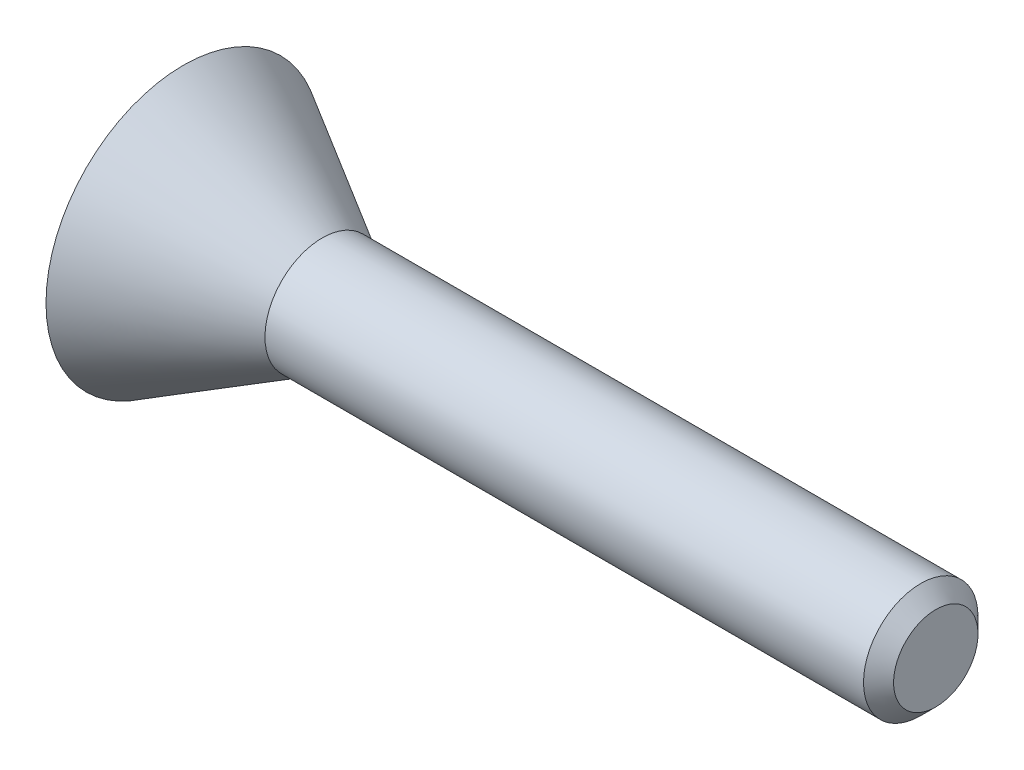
SolidWorks part; units mm, degrees
ref_plane "Front Plane" through (0, 0, 0) normal (0, 0, 1) x (1, 0, 0)
ref_plane "Top Plane" through (0, 0, 0) normal (0, 1, 0) x (1, 0, 0)
ref_plane "Right Plane" through (0, 0, 0) normal (1, 0, 0) x (0, 0, -1)
sketch "Sketch1" plane through (0, 0, 0) normal (1, 0, 0) x (0, 0, -1)
  circle A0 centre (0, 0) radius 4.2
  dimension "D1" = 8.4
extrude "Boss-Extrude1" add sketch "Sketch1" along normal mid plane 23 contours A0
sketch "Sketch2" plane through (0, 0, 0) normal (0, 0, 1) x (1, 0, 0)
  line L0 (-7.2565, 1.75) -> (11.5, 1.75)
  line L1 (11.5, -4.2) -> (11.5, 4.2) construction
  line L2 (11.5, 1.75) -> (11.5, 4.2)
  line L3 (-7.2565, 1.75) -> (-11.5, 4.2)
  line L4 (-11.5, 4.2) -> (11.5, 4.2)
  line L5 (-11.5, 4.2) -> (-11.5, -4.2) construction
  line L6 (-11.5, 0) -> (11.5, 0) construction
  dimension "D1" = 30
  dimension "D2" = 3.5
revolve "Cut-Revolve1" cut sketch "Sketch2" angle 360 about L6
sketch "Sketch3" plane through (-11.5, 0, 0) normal (-1, 0, 0) x (0, 0, 1)
  line L1 (0.42, 1.85) -> (0.42, -2.77)
  line L2 (1.01, 1.85) -> (0.42, 1.85)
  line L3 (0, 3.53) -> (1.01, 1.85)
  line L4 (0, 3.53) -> (-1.01, 1.85)
  line L5 (-1.01, 1.85) -> (-0.42, 1.85)
  line L6 (-0.42, 1.85) -> (-0.42, -2.77)
  line L7 (0, 4.2) -> (0, -4.2) construction
  arc A0 (-0.42, -2.77) -> (0.42, -2.77) centre (0, -2.77) ccw
  circle A1 centre (0, 0) radius 4.2 construction
  dimension "D6" = 0.84
  dimension "D2" = 1.01
  dimension "D3" = 2.02
  dimension "D1" = 0.67
  dimension "D5" = 1.68
extrude "Cut-Extrude1" cut sketch "Sketch3" against normal blind 0.6
chamfer "Chamfer1" distance 0.46 angle 45 1 edges at (11.5, -1.75, 0)
sketch "Sketch4" plane through (-11.5, 0, 0) normal (-1, 0, 0) x (0, 0, 1)
  text T0 "2  7" font "Bahnschrift" height 2.9
extrude "Cut-Extrude2" cut sketch "Sketch4" against normal blind 0.6
